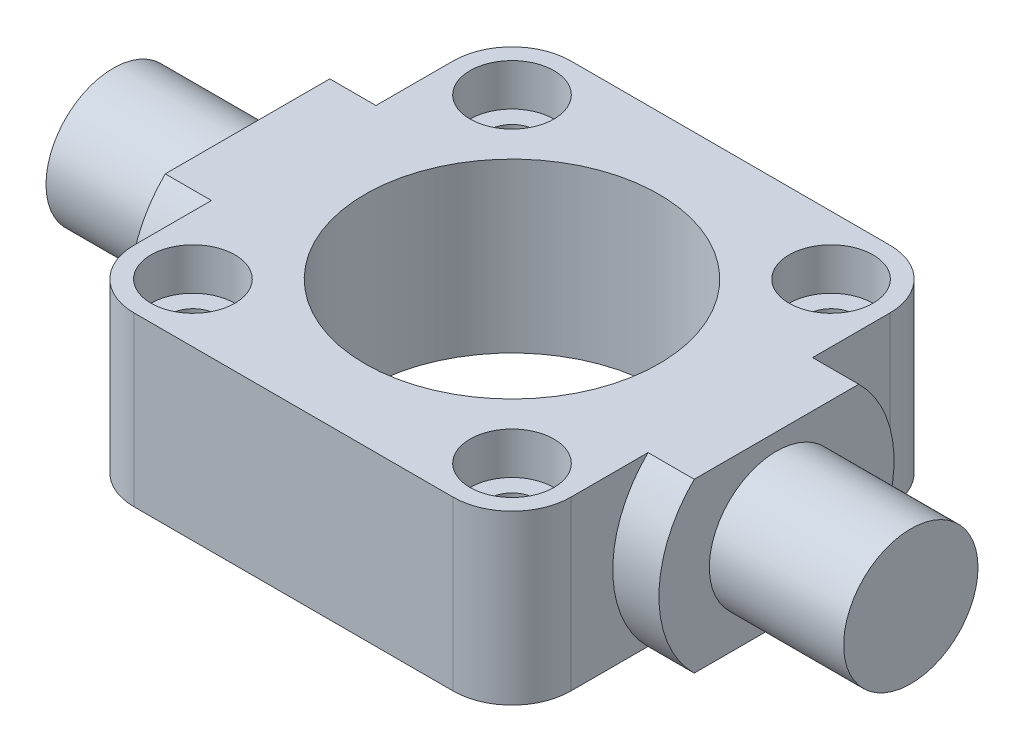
SolidWorks part; units mm, degrees
ref_plane "Plan de face" through (0, 0, 0) normal (0, 0, 1) x (1, 0, 0)
ref_plane "Plan de dessus" through (0, 0, 0) normal (0, 1, 0) x (1, 0, 0)
ref_plane "Plan de droite" through (0, 0, 0) normal (1, 0, 0) x (0, 0, -1)
sketch "Esquisse1" plane through (0, 0, 0) normal (0, 1, 0) x (1, 0, 0)
  line L0 (-26, 0) -> (26, 0) construction
  line L1 (-19, -26) -> (19, -26)
  line L2 (0, -26) -> (0, 26) construction
  line L3 (-19, 26) -> (19, 26)
  line L5 (26, -19) -> (26, 19)
  line L6 (-26, -19) -> (-26, 19)
  arc A0 (-26, -19) -> (-19, -26) centre (-19, -19) ccw
  arc A1 (-26, 19) -> (-19, 26) centre (-19, 19) cw
  arc A2 (26, 19) -> (19, 26) centre (19, 19) ccw
  arc A3 (26, -19) -> (19, -26) centre (19, -19) cw
  circle A4 centre (0, 0) radius 17.5
  dimension "D5" = 7
  dimension "D1" = 35
  dimension "D2" = 52
  dimension "D4" = 52
extrude "Extrusion1" add sketch "Esquisse1" along normal blind 20
sketch "Esquisse2" plane through (26, 0, 0) normal (1, 0, 0) x (0, 0, -1)
  line L2 (26, 20) -> (26, 0) construction
  line L5 (-19, 20) -> (-26, 20) construction
  circle A0 centre (0, 10) radius 14
  dimension "D1" = 28
  dimension "D2" = 26
  dimension "D3" = 10
extrude "Extrusion2" add sketch "Esquisse2" along normal blind 21.5
sketch "Esquisse3" plane through (-26, 0, 0) normal (-1, 0, 0) x (0, 0, 1)
  circle A0 centre (0, 10) radius 14
  arc A1 (9.798, 20) -> (-9.798, 20) centre (0, 10) ccw construction
extrude "Extrusion3" add sketch "Esquisse3" along normal blind 21.5
sketch "Esquisse4" plane through (-47.5, 0, 0) normal (-1, 0, 0) x (0, 0, 1)
  line L0 (26, 20) -> (26, 0) construction
  line L1 (-26, 20) -> (26, 20)
  line L2 (-26, 20) -> (-26, 30)
  line L3 (-26, 30) -> (26, 30)
  line L4 (26, 20) -> (26, 30)
  line L5 (-26, 0) -> (26, 0)
  line L6 (-26, -10) -> (26, -10)
  line L7 (-26, -10) -> (-26, 0)
  line L8 (26, -10) -> (26, 0)
  line L9 (-19, 0) -> (-9.798, 0) construction
  dimension "D1" = 10
  dimension "D2" = 10
extrude "Enlèv. mat.-Extru.1" cut sketch "Esquisse4" against normal through all
sketch "Esquisse5" plane through (-47.5, 0, 0) normal (-1, 0, 0) x (0, 0, 1)
  circle A0 centre (0, 10) radius 8
  arc A1 (9.798, 0) -> (9.798, 20) centre (0, 10) ccw construction
  dimension "D1" = 16
extrude "Enlèv. mat.-Extru.4" cut sketch "Esquisse5" against normal blind 16 flip side to cut
sketch "Esquisse6" plane through (47.5, 0, 0) normal (1, 0, 0) x (0, 0, -1)
  circle A0 centre (0, 10) radius 8
  circle A2 centre (0, 10) radius 8 construction
extrude "Enlèv. mat.-Extru.5" cut sketch "Esquisse6" against normal blind 16 flip side to cut
hole_wizard "Chambrage pour vis à tête hexagonale M51" positions "Esquisse8" profile "Esquisse7" counterbore size "M5" standard "ISO"
sketch "Esquisse8" plane through (0, 20, 0) normal (0, 1, 0) x (-1, 0, 0)
  circle A0 centre (0, 0) radius 17.5 construction
  point P0 (19, -19)
  point P1 (-19, -19)
  point P3 (-19, 19)
  point P5 (19, 19)
  dimension "D1" = 38
  dimension "D2" = 38
  dimension "D3" = 19
  dimension "D4" = 19
sketch "Esquisse7" plane through (-19, 20, -19) normal (1, 0, 0) x (0, 0, 1)
  line L0 (0, 0) -> (0, 20)
  line L1 (0, 20) -> (2.75, 20)
  line L3 (2.75, 20) -> (2.75, 5)
  line L4 (2.75, 5) -> (5, 5)
  line L5 (5, 5) -> (5, 0)
  line L7 (5, 0) -> (0, 0)
  line L11 (0, -6.35) -> (0, 107.95) construction
  dimension "Diamètre du perçage jusqu'au prochain" = 5.5
  dimension "Profondeur du perçage jusqu'au prochain" = 20
  dimension "Diamètre du chambrage" = 10
  dimension "Profondeur du chambrage" = 5
